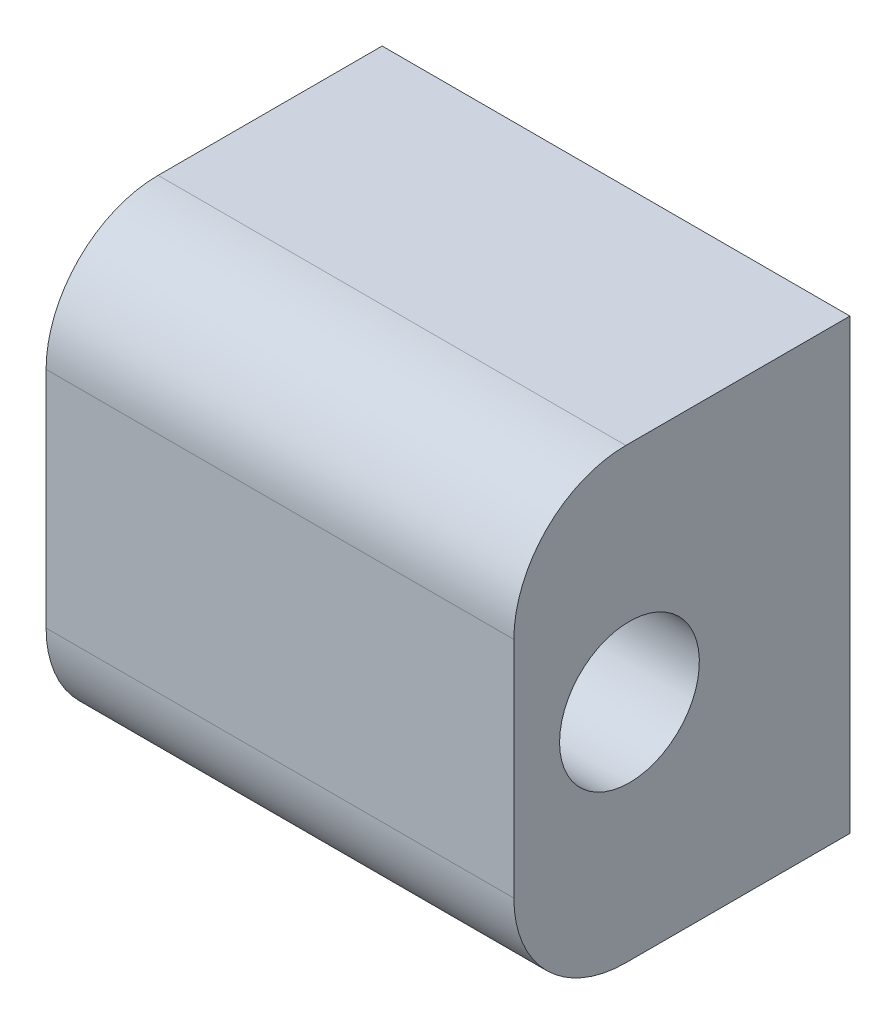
SolidWorks part; units mm, degrees
ref_plane "Front Plane" through (0, 0, 0) normal (0, 0, 1) x (1, 0, 0)
ref_plane "Top Plane" through (0, 0, 0) normal (0, 1, 0) x (1, 0, 0)
ref_plane "Right Plane" through (0, 0, 0) normal (1, 0, 0) x (0, 0, -1)
sketch "Sketch3" plane through (0, 0, 0) normal (0, 0, 1) x (1, 0, 0)
  line L0 (0, 0) -> (0, 16.8436) construction
  line L1 (0, 0) -> (13.2588, 0) construction
  line L2 (0, 0) -> (-13.2588, 0) construction
  line L3 (13.2588, 0) -> (13.2588, 12.7)
  line L4 (13.2588, 12.7) -> (-13.2588, 12.7)
  line L5 (-13.2588, 12.7) -> (-13.2588, 0)
  line L6 (-13.2588, 0) -> (-13.2588, -12.7)
  line L7 (-13.2588, -12.7) -> (13.2588, -12.7)
  line L8 (13.2588, -12.7) -> (13.2588, 0)
  circle A0 centre (-7.1374, 7.5438) radius 3.175
  circle A1 centre (7.1374, 7.5438) radius 3.175
  circle A2 centre (-7.1374, -7.5438) radius 3.175
  circle A3 centre (7.1374, -7.5438) radius 3.175
  dimension "D3" = 6.35
  dimension "D1" = 26.5176
  dimension "D2" = 25.4
  dimension "D4" = 15.0876
  dimension "D5" = 14.2748
  dimension "D6" = 5.1562
  dimension "D7" = 6.1214
  dimension "D8" = 7.5438
sketch "Sketch4" plane through (0, 0, 0) normal (0, 0, 1) x (1, 0, 0)
  line L0 (-13.2588, -12.7) -> (13.2588, -12.7) construction
  line L1 (13.2588, -12.7) -> (13.2588, 0) construction
  line L2 (13.2588, 0) -> (13.2588, 12.7) construction
  line L3 (13.2588, 12.7) -> (-13.2588, 12.7) construction
  line L4 (-13.2588, 12.7) -> (-13.2588, 0) construction
  line L5 (-13.2588, 0) -> (-13.2588, -12.7) construction
  line L6 (-13.2588, -12.7) -> (13.2588, -12.7)
  line L7 (13.2588, -12.7) -> (13.2588, 0)
  line L8 (13.2588, 0) -> (13.2588, 12.7)
  line L9 (13.2588, 12.7) -> (-13.2588, 12.7)
  line L10 (-13.2588, 12.7) -> (-13.2588, 0)
  line L11 (-13.2588, 0) -> (-13.2588, -12.7)
extrude "Boss-Extrude2" add sketch "Sketch4" along normal blind 19.05
sketch "Sketch5" plane through (-13.2588, 0, 0) normal (-1, 0, 0) x (0, 0, 1)
  line L0 (0, 0) -> (12.4968, 0) construction
  line L1 (0, 0) -> (0, -12.7) construction
  circle A0 centre (12.4968, 0) radius 3.9624
  dimension "D2" = 7.9248
  dimension "D1" = 12.4968
extrude "Cut-Extrude1" cut sketch "Sketch5" against normal blind 31.75
sketch "Sketch6" plane through (0, 0, 0) normal (0, 0, 1) x (1, 0, 0)
  circle A0 centre (-7.1374, -7.5438) radius 3.175 construction
  circle A1 centre (7.1374, -7.5438) radius 3.175 construction
  circle A2 centre (-7.1374, 7.5438) radius 3.175 construction
  circle A3 centre (7.1374, 7.5438) radius 3.175 construction
  circle A4 centre (-7.1374, -7.5438) radius 3.175
  circle A5 centre (7.1374, -7.5438) radius 3.175
  circle A6 centre (-7.1374, 7.5438) radius 3.175
  circle A7 centre (7.1374, 7.5438) radius 3.175
extrude "Cut-Extrude3" cut sketch "Sketch6" along normal blind 17.272
fillet "Fillet1" radius 6.35 2 edges at (0, 12.7, 19.05) (0, -12.7, 19.05)
chamfer "Chamfer1" distance 1.778 angle 59 4 edges at (-3.9624, 7.5438, 17.272) (-3.9624, -7.5438, 17.272) (10.3124, -7.5438, 17.272) (10.3124, 7.5438, 17.272)
